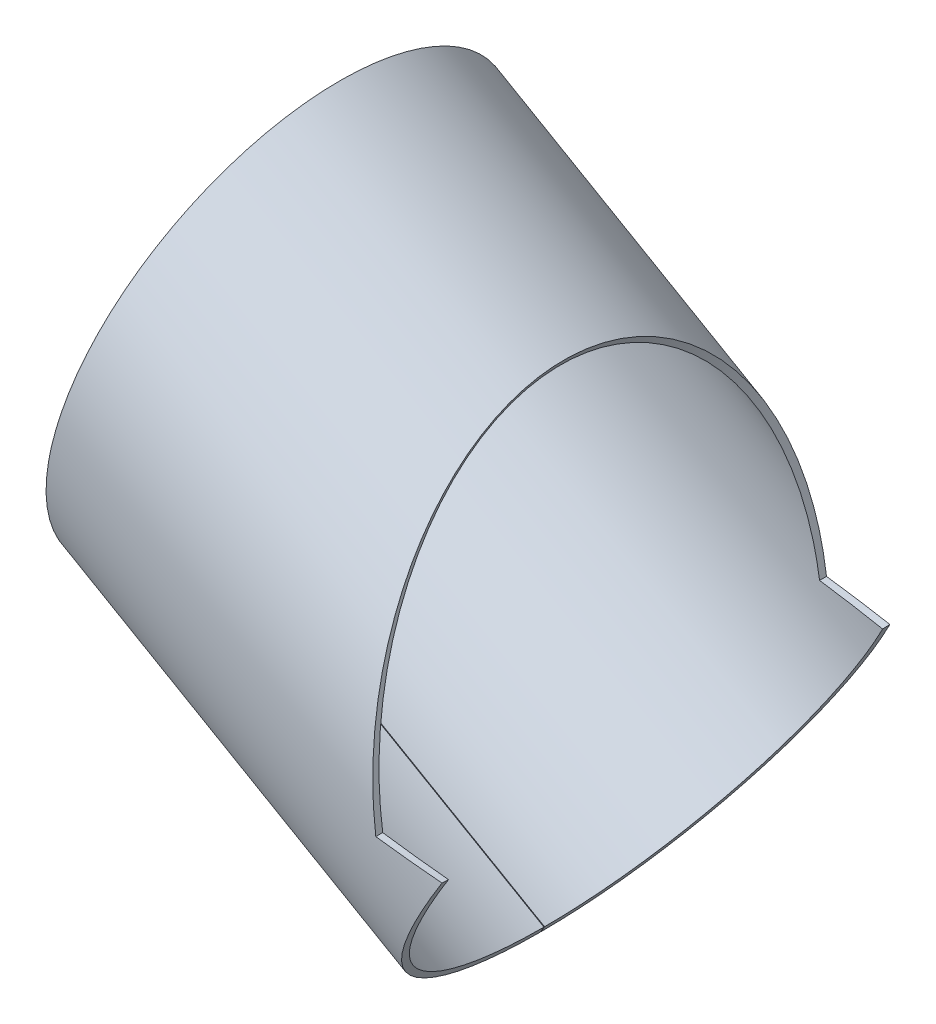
SolidWorks part; units mm, degrees
ref_plane "前视基准面" through (0, 0, 0) normal (0, 0, 1) x (1, 0, 0)
ref_plane "上视基准面" through (0, 0, 0) normal (0, 1, 0) x (1, 0, 0)
ref_plane "右视基准面" through (0, 0, 0) normal (1, 0, 0) x (0, 0, -1)
imported_body "基体零件-圆管斜插四节直角弯头-1"
sheet metal parameters "钣金1" parameters "D1"=0.7366, "厚度"=10
bend "圆角折弯1" bend radius 315 bend angle 359.824 parameters "D5"=1
flatten bends "展开-折弯1"
sketch "尖角-草图1" plane through (-587.0833, 541.0258, 0.5) normal (-0.5, -0.866, 0.0015) x (0.866, -0.5, 0.0009)
  line L0 (-267.0706, 989.3547) -> (268.8277, 988.8787) construction
  dimension "D1" = 0
process bends "加工-折弯1" parameters "D1"=0
sketch "平面-草图1" plane through (-587.0833, 541.0258, 0.5) normal (-0.5, -0.866, 0.0015) x (0.866, -0.5, 0.0009)
